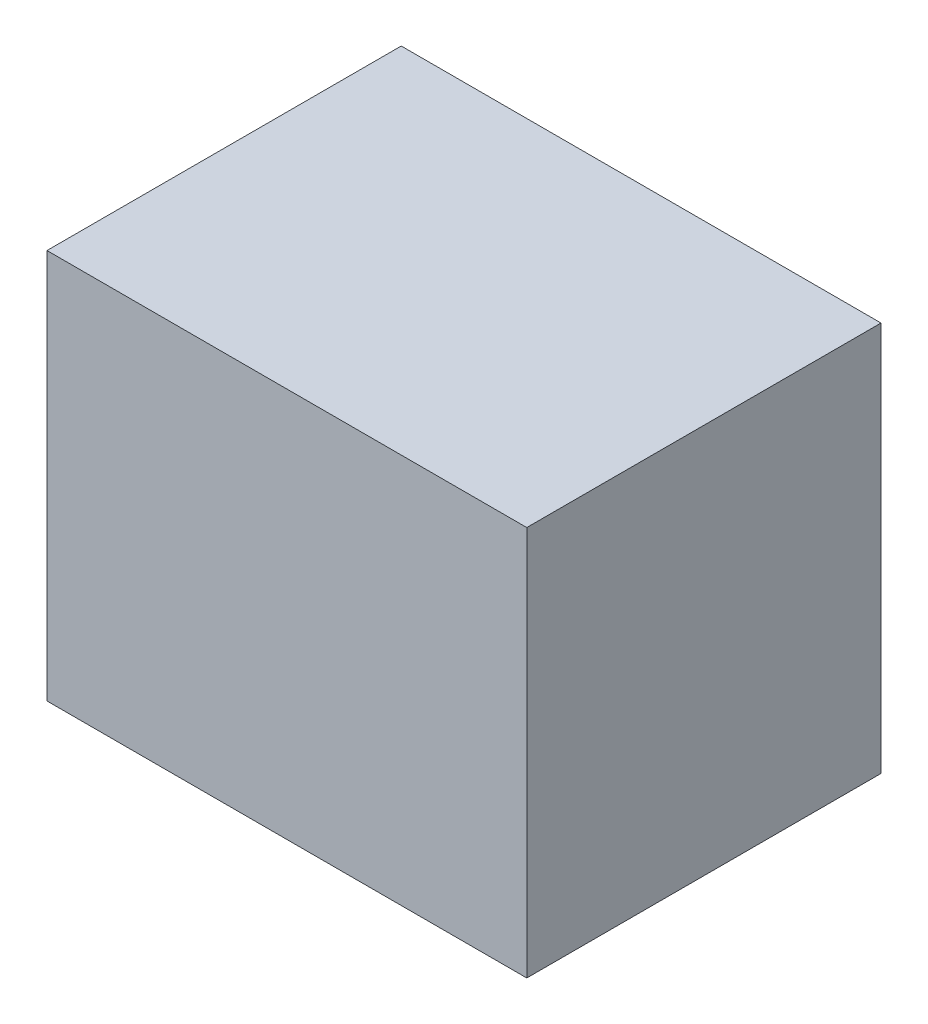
SolidWorks part; units mm, degrees
ref_plane "Alzado" through (0, 0, 0) normal (0, 0, 1) x (1, 0, 0)
ref_plane "Planta" through (0, 0, 0) normal (0, 1, 0) x (1, 0, 0)
ref_plane "Vista lateral" through (0, 0, 0) normal (1, 0, 0) x (0, 0, -1)
sketch "Sketch1" plane through (0, 0, 0) normal (0, 0, 1) x (1, 0, 0)
  line L1 (-53.5, -43.5) -> (53.5, -43.5)
  line L2 (-53.5, -43.5) -> (-53.5, 43.5)
  line L3 (-53.5, 43.5) -> (53.5, 43.5)
  line L4 (53.5, -43.5) -> (53.5, 43.5)
  line L5 (-53.5, -43.5) -> (53.5, 43.5) construction
  line L6 (-53.5, 43.5) -> (53.5, -43.5) construction
  point P0 (0, 0)
  dimension "D1" = 107
  dimension "D2" = 87
extrude "Boss-Extrude1" add sketch "Sketch1" along normal blind 79
sketch "Sketch2" plane through (0, 0, 0) normal (0, 1, 0) x (1, 0, 0)
  line L0 (53.5, 0) -> (-53.5, 0) construction
  line L1 (-44, 0) -> (44, 0) construction
  line L7 (-46.5, 0) -> (-36.3811, -72)
  line L8 (-36.3811, -72) -> (36.3811, -72)
  line L9 (36.3811, -72) -> (46.5, 0)
  line L10 (53.5, -79) -> (-53.5, -79) construction
  line L11 (-46.5, 0) -> (46.5, 0)
extrude "Cut-Extrude1" cut sketch "Sketch2" against normal blind 37.5 and the other way blind 37.5
ref_plane "Plane1" through (0, -38.5, 0) normal (0, -1, 0) x (-1, 0, 0)
sketch "Sketch3" plane through (0, -38.5, 0) normal (0, -1, 0) x (-1, 0, 0)
  line L0 (53.5, 0) -> (-53.5, 0) construction
  line L1 (-53.5, -79) -> (-53.5, 0) construction
  line L2 (-48.5, 1.5) -> (-48.5, -1.5)
  arc A0 (-48.5, 1.5) -> (-48.5, -1.5) centre (-48.5, 0) ccw
  dimension "D1" = 3
  dimension "D2" = 5
revolve "Cut-Revolve1" cut sketch "Sketch3" angle 360 about L2
pattern_linear "LPattern1" count 2 spacing 97.2 along (-1, 0, 0) count 2 spacing 77.2 along (0, 1, 0) of "Cut-Revolve1"
equation "\"ancho\"=37.5"
equation "\"D1@Cut-Extrude1\"=\"ancho\""
equation "\"D2@Cut-Extrude1\"=\"ancho\""
equation "\"pared\"=7"
equation "\"D3@Sketch2\"=\"pared\""
equation "\"D4@Sketch2\"=\"pared\""
equation "\"D7@Sketch2\"=\"pared\""
equation "\"angulo\"=98"
equation "\"D5@Sketch2\"=\"angulo\""
equation "\"D6@Sketch2\"=\"angulo\""
